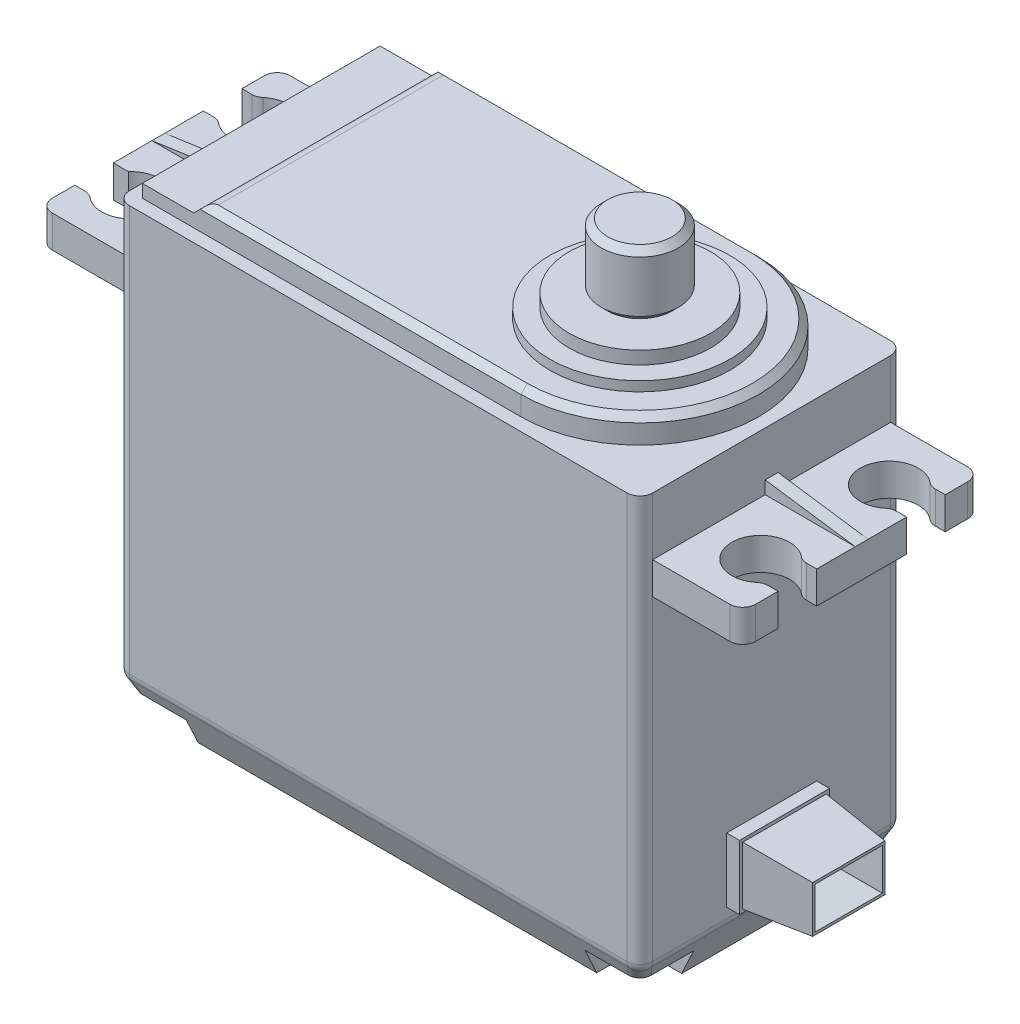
SolidWorks part; units mm, degrees
ref_plane "Alzado" through (0, 0, 0) normal (0, 0, 1) x (1, 0, 0)
ref_plane "Planta" through (0, 0, 0) normal (0, 1, 0) x (1, 0, 0)
ref_plane "Vista lateral" through (0, 0, 0) normal (1, 0, 0) x (0, 0, -1)
sketch "Croquis1" plane through (0, 0, 0) normal (0, 0, 1) x (1, 0, 0)
  line L1 (-20.35, -17.5) -> (20.35, -17.5)
  line L2 (-20.35, -17.5) -> (-20.35, 17.5)
  line L3 (-20.35, 17.5) -> (20.35, 17.5)
  line L4 (20.35, -17.5) -> (20.35, 17.5)
  line L5 (-20.35, -17.5) -> (20.35, 17.5) construction
  line L6 (-20.35, 17.5) -> (20.35, -17.5) construction
  point P0 (0, 0)
  dimension "D1" = 40.7
  dimension "D2" = 35
extrude "Saliente-Extruir1" add sketch "Croquis1" along normal mid plane 20.5
ref_plane "Plano1" through (0, 0, 9.25) normal (0, 0, 1) x (1, 0, 0)
sketch "Croquis2" plane through (0, 0, 9.25) normal (0, 0, 1) x (1, 0, 0)
  line L1 (-20.35, 13) -> (-27.35, 13)
  line L2 (-20.35, 13) -> (-20.35, 10.5)
  line L3 (-20.35, 10.5) -> (-27.35, 10.5)
  line L4 (-27.35, 13) -> (-27.35, 10.5)
  line L5 (-20.35, -17.5) -> (20.35, -17.5) construction
  line L6 (0, 17.5) -> (0, -17.5) construction
  line L7 (20.35, 17.5) -> (-20.35, 17.5) construction
  line L8 (20.35, 13) -> (20.35, 10.5)
  line L9 (20.35, 10.5) -> (27.35, 10.5)
  line L10 (27.35, 13) -> (27.35, 10.5)
  line L11 (20.35, 13) -> (27.35, 13)
  line L12 (-20.35, 17.5) -> (-20.35, -17.5) construction
  dimension "D1" = 2.5
  dimension "D2" = 7
  dimension "D3" = 28
extrude "Saliente-Extruir2" add sketch "Croquis2" against normal blind 18.5
sketch "Croquis3" plane through (0, 0, 0) normal (0, 0, 1) x (1, 0, 0)
  line L0 (-20.35, 14) -> (-20.35, 13)
  line L2 (-20.35, 13) -> (-27.35, 13)
  line L3 (-27.35, 13) -> (-20.35, 14)
  line L4 (20.35, 14) -> (27.35, 13)
  line L6 (27.35, 13) -> (20.35, 13)
  line L7 (20.35, 13) -> (20.35, 14)
  line L8 (-20.35, 17.5) -> (-20.35, -17.5) construction
  line L9 (20.35, -17.5) -> (20.35, 17.5) construction
  dimension "D1" = 1
extrude "Saliente-Extruir3" add sketch "Croquis3" along normal mid plane 1
sketch "Croquis4" plane through (0, 13, 0) normal (0, 1, 0) x (1, 0, 0)
  line L0 (-27.35, 6.5) -> (-26.1771, 6.5)
  line L1 (-24.5, -5) -> (24.5, -5) construction
  line L2 (-24.5, -5) -> (-24.5, 5) construction
  line L3 (-24.5, 5) -> (24.5, 5) construction
  line L4 (24.5, -5) -> (24.5, 5) construction
  line L5 (-24.5, -5) -> (24.5, 5) construction
  line L6 (-24.5, 5) -> (24.5, -5) construction
  line L7 (-27.35, 9.25) -> (-27.35, 0.5) construction
  line L8 (-27.35, 3.5) -> (-26.1771, 3.5)
  line L9 (-27.35, -3.5) -> (-26.1771, -3.5)
  line L10 (-27.35, -0.5) -> (-27.35, -9.25) construction
  line L11 (-27.35, -6.5) -> (-26.1771, -6.5)
  line L12 (26.1771, -6.5) -> (27.35, -6.5)
  line L13 (27.35, -0.5) -> (27.35, -9.25) construction
  line L14 (27.35, -3.5) -> (26.1771, -3.5)
  line L15 (27.35, 3.5) -> (26.1771, 3.5)
  line L16 (27.35, 9.25) -> (27.35, 0.5) construction
  line L17 (27.35, 6.5) -> (26.1771, 6.5)
  line L18 (27.35, 6.5) -> (27.35, 3.5)
  line L19 (27.35, -3.5) -> (27.35, -6.5)
  line L20 (-27.35, -3.5) -> (-27.35, -6.5)
  line L21 (-27.35, 3.5) -> (-27.35, 6.5)
  line L22 (-27.35, 5) -> (-24.5, 5) construction
  line L23 (-24.5, -5) -> (-27.35, -5) construction
  line L24 (24.5, -5) -> (27.35, -5) construction
  line L25 (24.5, 5) -> (27.35, 5) construction
  arc A0 (26.1771, 6.5) -> (26.1771, 3.5) centre (24.5, 5) ccw
  arc A1 (26.1771, -3.5) -> (26.1771, -6.5) centre (24.5, -5) ccw
  arc A2 (-26.1771, -6.5) -> (-26.1771, -3.5) centre (-24.5, -5) ccw
  arc A3 (-26.1771, 3.5) -> (-26.1771, 6.5) centre (-24.5, 5) ccw
  point P0 (0, 0)
  dimension "D3" = 4.5
  dimension "D1" = 49
  dimension "D2" = 10
  dimension "D4" = 3
extrude "Cortar-Extruir1" cut sketch "Croquis4" against normal up to vertex
chamfer "Chaflán1" distance 1.5 angle 65 4 edges at (0, -17.5, -10.25) (-20.35, -17.5, 0) (0, -17.5, 10.25) (20.35, -17.5, 0)
sketch "Croquis5" plane through (0, -17.5, 0) normal (0, -1, 0) x (1, 0, 0)
  line L0 (-17.5, 0) -> (17.5, 0) construction
  line L1 (-17.5, -7.5) -> (17.5, -7.5) construction
  line L2 (-17.5, -7.5) -> (-17.5, 7.5) construction
  line L3 (-17.5, 7.5) -> (17.5, 7.5) construction
  line L4 (17.5, -7.5) -> (17.5, 7.5) construction
  line L5 (-17.5, -7.5) -> (17.5, 7.5) construction
  line L6 (-17.5, 7.5) -> (17.5, -7.5) construction
  line L7 (0, 7.5) -> (0, -7.5) construction
  line L8 (-20.35, 5.5) -> (-17.5, 5.5)
  line L10 (-15.5, 7.5) -> (-15.5, 10.25)
  line L12 (-20.35, 10.25) -> (20.35, 10.25) construction
  line L13 (-20.35, -9.25) -> (-20.35, 9.25) construction
  line L14 (-15.5, 10.25) -> (-20.35, 10.25)
  line L15 (-20.35, 10.25) -> (-20.35, 5.5)
  line L16 (-20.35, -10.25) -> (-20.35, -5.5)
  line L17 (-15.5, -10.25) -> (-20.35, -10.25)
  line L18 (-15.5, -7.5) -> (-15.5, -10.25)
  line L19 (-20.35, -5.5) -> (-17.5, -5.5)
  line L20 (20.35, -5.5) -> (17.5, -5.5)
  line L21 (15.5, -7.5) -> (15.5, -10.25)
  line L22 (15.5, -10.25) -> (20.35, -10.25)
  line L23 (20.35, -10.25) -> (20.35, -5.5)
  line L24 (20.35, 10.25) -> (20.35, 5.5)
  line L25 (15.5, 10.25) -> (20.35, 10.25)
  line L26 (15.5, 7.5) -> (15.5, 10.25)
  line L27 (20.35, 5.5) -> (17.5, 5.5)
  arc A0 (-17.5, 5.5) -> (-15.5, 7.5) centre (-17.5, 7.5) ccw
  arc A1 (-17.5, -5.5) -> (-15.5, -7.5) centre (-17.5, -7.5) cw
  arc A2 (17.5, -5.5) -> (15.5, -7.5) centre (17.5, -7.5) ccw
  arc A3 (17.5, 5.5) -> (15.5, 7.5) centre (17.5, 7.5) cw
  point P0 (0, 0)
  dimension "D3" = 2
  dimension "D1" = 35
  dimension "D2" = 15
extrude "Cortar-Extruir2" cut sketch "Croquis5" against normal blind 2
sketch "Croquis6" plane through (0, 17.5, 0) normal (0, 1, 0) x (1, 0, 0)
  line L1 (20.35, 10.25) -> (-20.35, 10.25) construction
  line L2 (-20.35, -10.25) -> (-20.35, 10.25) construction
  line L3 (20.35, -10.25) -> (-20.35, -10.25) construction
  line L4 (20.35, -10.25) -> (20.35, 10.25) construction
  line L5 (20.35, 10.25) -> (-20.35, 10.25) construction
  line L6 (-20.35, -10.25) -> (-20.35, 10.25) construction
  line L7 (20.35, -10.25) -> (-20.35, -10.25) construction
  line L8 (20.35, -10.25) -> (20.35, 10.25) construction
  line L9 (10.1, 9.25) -> (-19.35, 9.25)
  line L10 (-19.35, -9.25) -> (-19.35, 9.25)
  line L11 (10.1, -9.25) -> (-19.35, -9.25)
  line L12 (19.35, -9.25) -> (19.35, 9.25) construction
  line L13 (19.35, 9.25) -> (-19.35, 9.25) construction
  line L14 (19.35, -9.25) -> (-19.35, -9.25) construction
  arc A0 (10.1, -9.25) -> (10.1, 9.25) centre (10.1, 0) ccw
  dimension "D1" = 1
extrude "Saliente-Extruir4" add sketch "Croquis6" along normal blind 2
sketch "Croquis9" plane through (0, 0, 9.25) normal (0, 0, 1) x (1, 0, 0)
  line L0 (-19.35, 19.5) -> (-19.35, 18.5)
  line L2 (-19.35, 18.5) -> (-15.35, 18.5)
  line L3 (-15.35, 18.5) -> (-14.35, 19.5)
  line L5 (-14.35, 19.5) -> (-19.35, 19.5)
  line L7 (-19.35, 19.5) -> (-19.35, 17.5) construction
  line L8 (-19.35, 19.5) -> (10.1, 19.5) construction
  dimension "D1" = 5
  dimension "D2" = 45
extrude "Cortar-Extruir3" cut sketch "Croquis9" against normal up to vertex
sketch "Croquis10" plane through (0, 19.5, 0) normal (0, 1, 0) x (1, 0, 0)
  circle A1 centre (10.1, 0) radius 7
  arc A2 (10.1, -9.25) -> (10.1, 9.25) centre (10.1, 0) ccw construction
  dimension "D1" = 14
extrude "Saliente-Extruir5" add sketch "Croquis10" along normal blind 0.75
sketch "Croquis11" plane through (0, 20.25, 0) normal (0, 1, 0) x (1, 0, 0)
  circle A0 centre (10.1, 0) radius 5.5
  circle A1 centre (10.1, 0) radius 7
  circle A2 centre (10.1, 0) radius 7 construction
  dimension "D1" = 0
  dimension "D2" = 1.5
extrude "Saliente-Extruir6" add sketch "Croquis11" along normal blind 1
sketch "Croquis12" plane through (0, 21.25, 0) normal (0, 1, 0) x (1, 0, 0)
  circle A0 centre (10.1, 0) radius 3
  circle A1 centre (10.1, 0) radius 5.5 construction
  dimension "D1" = 6
extrude "Saliente-Extruir7" add sketch "Croquis12" along normal blind 5
sketch "Croquis14" plane through (20.35, 0, 0) normal (1, 0, 0) x (0, 0, -1)
  line L0 (0, 0) -> (0, -10.7832) construction
  line L1 (-3.5, -13.2832) -> (3.5, -13.2832)
  line L2 (-3.5, -13.2832) -> (-3.5, -8.2832)
  line L3 (-3.5, -8.2832) -> (3.5, -8.2832)
  line L4 (3.5, -13.2832) -> (3.5, -8.2832)
  line L5 (-3.5, -13.2832) -> (3.5, -8.2832) construction
  line L6 (-3.5, -8.2832) -> (3.5, -13.2832) construction
  line L7 (-10.25, -14.2832) -> (10.25, -14.2832) construction
  point P0 (0, -10.7832)
  dimension "D1" = 7
  dimension "D2" = 5
  dimension "D3" = 3.5
extrude "Saliente-Extruir8" add sketch "Croquis14" along normal blind 1
sketch "Croquis15" plane through (21.35, 0, 0) normal (1, 0, 0) x (0, 0, -1)
  line L0 (3.25, -8.5332) -> (-3.25, -8.5332)
  line L1 (-3.25, -8.5332) -> (-3.25, -13.0332)
  line L2 (-3.25, -13.0332) -> (3.25, -13.0332)
  line L3 (3.25, -13.0332) -> (3.25, -8.5332)
  line L4 (3.5, -13.2832) -> (3.5, -8.2832)
  line L5 (3.5, -8.2832) -> (-3.5, -8.2832)
  line L6 (-3.5, -8.2832) -> (-3.5, -13.2832)
  line L7 (-3.5, -13.2832) -> (3.5, -13.2832)
  line L8 (3.5, -13.2832) -> (3.5, -8.2832) construction
  line L9 (3.5, -8.2832) -> (-3.5, -8.2832) construction
  line L10 (-3.5, -8.2832) -> (-3.5, -13.2832) construction
  line L11 (-3.5, -13.2832) -> (3.5, -13.2832) construction
  dimension "D1" = 0
  dimension "D2" = 0.25
extrude "Saliente-Extruir9" add sketch "Croquis15" along normal blind 5 draft 5 separate body
shell "Vaciado2" thickness 0.2
chamfer "Chaflán2" distance 0.5 angle 45 1 edges at (10.1, 26.25, 3)
sketch "Croquis13" plane through (0, 0, 0) normal (0, 0, 1) x (1, 0, 0)
  line L0 (7.1, 21.75) -> (7.1, 21.25)
  line L1 (7.1, 25.75) -> (7.1, 21.25) construction
  line L2 (7.1, 21.25) -> (7.6, 21.25)
  line L3 (15.6, 21.25) -> (4.6, 21.25) construction
  line L4 (7.6, 21.25) -> (7.1, 21.75)
  line L5 (7.6, 26.25) -> (7.1, 25.75) construction
  line L6 (10.1, 26.25) -> (10.1, 21.25) construction
  line L7 (12.6, 26.25) -> (7.6, 26.25) construction
revolve "Cortar-Revolución1" cut sketch "Croquis13" angle 360 about L6
fillet "Redondeo2" radius 1 24 edges at (20.0663, -14.8916, 9.9663) (20.35, 1.6084, 10.25) (-20.0663, -14.8916, 9.9663) (-20.35, 1.6084, 10.25) (-20.0663, -14.8916, -9.9663) (-20.35, 1.6084, -10.25) (20.0663, -14.8916, -9.9663) (20.35, 1.6084, -10.25) (-14.35, 19.5, 0) (-26.1771, 11.75, 6.5) (-26.1771, 11.75, -3.5) (-26.1771, 11.75, -6.5) (26.1771, 11.75, -6.5) (26.1771, 11.75, 3.5) (26.1771, 11.75, -3.5) (26.1771, 11.75, 6.5) (27.35, 11.75, 9.25) (27.35, 11.75, -9.25) (-27.35, 11.75, 9.25) (-27.35, 11.75, -9.25) (-20.35, -14.2832, 0) (0, -14.2832, 10.25) (20.35, -14.2832, 0) (0, -14.2832, -10.25)
sketch "Croquis16" plane through (0, 13, 0) normal (0, 1, 0) x (1, 0, 0)
  line L0 (-20.35, 9.25) -> (-26.35, 9.25) construction
  line L1 (-27.35, 8.25) -> (-27.35, 6.5) construction
  line L2 (-26.5767, 6.5) -> (-27.35, 6.5) construction
  line L3 (-27.35, 3.5) -> (-26.5767, 3.5) construction
  line L4 (-27.35, 3.5) -> (-27.35, 0.5) construction
  line L5 (-27.35, -0.5) -> (-27.35, -3.5) construction
  line L6 (-27.35, -0.5) -> (-27.35, 0.5) construction
  line L7 (-26.1771, -3.5) -> (-27.35, -3.5) construction
  line L8 (-27.35, -6.5) -> (-26.5767, -6.5) construction
  line L9 (-27.35, -6.5) -> (-27.35, -8.25) construction
  line L10 (-20.35, -9.25) -> (-26.35, -9.25) construction
  line L11 (19.35, -10.25) -> (-19.35, -10.25) construction
  line L12 (26.35, -9.25) -> (20.35, -9.25) construction
  line L13 (27.35, -6.5) -> (27.35, -8.25) construction
  line L14 (26.5767, -6.5) -> (27.35, -6.5) construction
  line L15 (27.35, -3.5) -> (26.5767, -3.5) construction
  line L16 (27.35, -0.5) -> (27.35, -3.5) construction
  line L17 (27.35, -0.5) -> (27.35, 0.5) construction
  line L18 (27.35, 3.5) -> (27.35, 0.5) construction
  line L19 (26.5767, 3.5) -> (27.35, 3.5) construction
  line L20 (27.35, 6.5) -> (26.5767, 6.5) construction
  line L21 (27.35, 8.25) -> (27.35, 6.5) construction
  line L22 (26.35, 9.25) -> (20.35, 9.25) construction
  line L23 (19.35, 10.25) -> (-19.35, 10.25) construction
  line L24 (-20.35, 9.25) -> (-26.35, 9.25)
  line L25 (-27.35, 8.25) -> (-27.35, 6.5)
  line L26 (-26.5767, 6.5) -> (-27.35, 6.5)
  line L27 (-27.35, 3.5) -> (-26.5767, 3.5)
  line L28 (-27.35, 3.5) -> (-27.35, 0.5)
  line L29 (-27.35, -0.5) -> (-27.35, -3.5)
  line L30 (-27.35, -0.5) -> (-27.35, 0.5)
  line L31 (-26.1771, -3.5) -> (-27.35, -3.5)
  line L32 (-27.35, -6.5) -> (-26.5767, -6.5)
  line L33 (-27.35, -6.5) -> (-27.35, -8.25)
  line L34 (-20.35, -9.25) -> (-26.35, -9.25)
  line L35 (19.35, -10.25) -> (-19.35, -10.25)
  line L36 (26.35, -9.25) -> (20.35, -9.25)
  line L37 (27.35, -6.5) -> (27.35, -8.25)
  line L38 (26.5767, -6.5) -> (27.35, -6.5)
  line L39 (27.35, -3.5) -> (26.5767, -3.5)
  line L40 (27.35, -0.5) -> (27.35, -3.5)
  line L41 (27.35, -0.5) -> (27.35, 0.5)
  line L42 (27.35, 3.5) -> (27.35, 0.5)
  line L43 (26.5767, 3.5) -> (27.35, 3.5)
  line L44 (27.35, 6.5) -> (26.5767, 6.5)
  line L45 (27.35, 8.25) -> (27.35, 6.5)
  line L46 (26.35, 9.25) -> (20.35, 9.25)
  line L47 (19.35, 10.25) -> (-19.35, 10.25)
  arc A0 (-26.35, 9.25) -> (-27.35, 8.25) centre (-26.35, 8.25) ccw construction
  arc A1 (-26.5767, 6.5) -> (-25.9377, 6.7308) centre (-26.5767, 7.5) ccw construction
  arc A2 (-25.9377, 3.2692) -> (-25.9377, 6.7308) centre (-24.5, 5) ccw construction
  arc A3 (-25.9377, 3.2692) -> (-26.5767, 3.5) centre (-26.5767, 2.5) ccw construction
  arc A4 (-25.9377, -6.7308) -> (-26.1771, -3.5) centre (-24.5, -5) ccw construction
  arc A5 (-25.9377, -6.7308) -> (-26.5767, -6.5) centre (-26.5767, -7.5) ccw construction
  arc A6 (-27.35, -8.25) -> (-26.35, -9.25) centre (-26.35, -8.25) ccw construction
  arc A7 (-20.35, -9.25) -> (-19.35, -10.25) centre (-19.35, -9.25) ccw construction
  arc A8 (19.35, -10.25) -> (20.35, -9.25) centre (19.35, -9.25) ccw construction
  arc A9 (26.35, -9.25) -> (27.35, -8.25) centre (26.35, -8.25) ccw construction
  arc A10 (26.5767, -6.5) -> (25.9377, -6.7308) centre (26.5767, -7.5) ccw construction
  arc A11 (25.9377, -3.2692) -> (25.9377, -6.7308) centre (24.5, -5) ccw construction
  arc A12 (25.9377, -3.2692) -> (26.5767, -3.5) centre (26.5767, -2.5) ccw construction
  arc A13 (26.5767, 3.5) -> (25.9377, 3.2692) centre (26.5767, 2.5) ccw construction
  arc A14 (25.9377, 6.7308) -> (25.9377, 3.2692) centre (24.5, 5) ccw construction
  arc A15 (25.9377, 6.7308) -> (26.5767, 6.5) centre (26.5767, 7.5) ccw construction
  arc A16 (27.35, 8.25) -> (26.35, 9.25) centre (26.35, 8.25) ccw construction
  arc A17 (20.35, 9.25) -> (19.35, 10.25) centre (19.35, 9.25) ccw construction
  arc A18 (-19.35, 10.25) -> (-20.35, 9.25) centre (-19.35, 9.25) ccw construction
  circle A19 centre (10.1, 0) radius 2.5 construction
  arc A20 (-26.35, 9.25) -> (-27.35, 8.25) centre (-26.35, 8.25) ccw
  arc A21 (-26.5767, 6.5) -> (-25.9377, 6.7308) centre (-26.5767, 7.5) ccw
  arc A22 (-25.9377, 3.2692) -> (-25.9377, 6.7308) centre (-24.5, 5) ccw
  arc A23 (-25.9377, 3.2692) -> (-26.5767, 3.5) centre (-26.5767, 2.5) ccw
  arc A24 (-25.9377, -6.7308) -> (-26.1771, -3.5) centre (-24.5, -5) ccw
  arc A25 (-25.9377, -6.7308) -> (-26.5767, -6.5) centre (-26.5767, -7.5) ccw
  arc A26 (-27.35, -8.25) -> (-26.35, -9.25) centre (-26.35, -8.25) ccw
  arc A27 (-20.35, -9.25) -> (-19.35, -10.25) centre (-19.35, -9.25) ccw
  arc A28 (19.35, -10.25) -> (20.35, -9.25) centre (19.35, -9.25) ccw
  arc A29 (26.35, -9.25) -> (27.35, -8.25) centre (26.35, -8.25) ccw
  arc A30 (26.5767, -6.5) -> (25.9377, -6.7308) centre (26.5767, -7.5) ccw
  arc A31 (25.9377, -3.2692) -> (25.9377, -6.7308) centre (24.5, -5) ccw
  arc A32 (25.9377, -3.2692) -> (26.5767, -3.5) centre (26.5767, -2.5) ccw
  arc A33 (26.5767, 3.5) -> (25.9377, 3.2692) centre (26.5767, 2.5) ccw
  arc A34 (25.9377, 6.7308) -> (25.9377, 3.2692) centre (24.5, 5) ccw
  arc A35 (25.9377, 6.7308) -> (26.5767, 6.5) centre (26.5767, 7.5) ccw
  arc A36 (27.35, 8.25) -> (26.35, 9.25) centre (26.35, 8.25) ccw
  arc A37 (20.35, 9.25) -> (19.35, 10.25) centre (19.35, 9.25) ccw
  arc A38 (-19.35, 10.25) -> (-20.35, 9.25) centre (-19.35, 9.25) ccw
  circle A39 centre (10.1, 0) radius 2.5
sketch "Croquis17" plane through (-20.35, 0, 0) normal (-1, 0, 0) x (0, 0, 1)
  line L0 (-9.0429, 19.2071) -> (-9.25, 19) construction
  line L1 (-8.75, 19.5) -> (-9.0429, 19.2071) construction
  line L2 (-8.75, 19.5) -> (8.75, 19.5) construction
  line L3 (-9.25, 18.5) -> (-9.25, 19) construction
  line L4 (-9.25, 18.5) -> (-9.25, 17.5) construction
  line L5 (-9.25, 17.5) -> (-10.25, 17.5) construction
  line L6 (-10.25, -14.0615) -> (-10.25, 17.5) construction
  line L7 (-9.6826, -15.5) -> (-10.1563, -14.4842) construction
  line L8 (-9.6826, -15.5) -> (-8.75, -17.5) construction
  line L9 (-8.75, -17.5) -> (-7.5, -17.5) construction
  line L10 (-7.5, -17.5) -> (-5.5, -17.5) construction
  line L11 (5.5, -17.5) -> (-5.5, -17.5) construction
  line L12 (5.5, -17.5) -> (7.5, -17.5) construction
  line L13 (7.5, -17.5) -> (8.75, -17.5) construction
  line L14 (8.75, -17.5) -> (9.6826, -15.5) construction
  line L15 (10.1563, -14.4842) -> (9.6826, -15.5) construction
  line L16 (10.25, 17.5) -> (10.25, -14.0615) construction
  line L17 (10.25, 17.5) -> (9.25, 17.5) construction
  line L18 (9.25, 18.5) -> (9.25, 17.5) construction
  line L19 (9.25, 18.5) -> (9.25, 19) construction
  line L20 (9.25, 19) -> (9.0429, 19.2071) construction
  line L21 (9.0429, 19.2071) -> (8.75, 19.5) construction
  line L22 (-9.0429, 19.2071) -> (-9.25, 19)
  line L23 (-8.75, 19.5) -> (-9.0429, 19.2071)
  line L24 (-8.75, 19.5) -> (8.75, 19.5)
  line L25 (-9.25, 18.5) -> (-9.25, 19)
  line L26 (-9.25, 18.5) -> (-9.25, 17.5)
  line L27 (-9.25, 17.5) -> (-10.25, 17.5)
  line L28 (-10.25, -14.0615) -> (-10.25, 17.5)
  line L29 (-9.6826, -15.5) -> (-10.1563, -14.4842)
  line L30 (-9.6826, -15.5) -> (-8.75, -17.5)
  line L31 (-8.75, -17.5) -> (-7.5, -17.5)
  line L32 (-7.5, -17.5) -> (-5.5, -17.5)
  line L33 (5.5, -17.5) -> (-5.5, -17.5)
  line L34 (5.5, -17.5) -> (7.5, -17.5)
  line L35 (7.5, -17.5) -> (8.75, -17.5)
  line L36 (8.75, -17.5) -> (9.6826, -15.5)
  line L37 (10.1563, -14.4842) -> (9.6826, -15.5)
  line L38 (10.25, 17.5) -> (10.25, -14.0615)
  line L39 (10.25, 17.5) -> (9.25, 17.5)
  line L40 (9.25, 18.5) -> (9.25, 17.5)
  line L41 (9.25, 18.5) -> (9.25, 19)
  line L42 (9.25, 19) -> (9.0429, 19.2071)
  line L43 (9.0429, 19.2071) -> (8.75, 19.5)
  arc A0 (-10.25, -14.0615) -> (-10.1563, -14.4842) centre (-9.25, -14.0615) ccw construction
  arc A1 (10.1563, -14.4842) -> (10.25, -14.0615) centre (9.25, -14.0615) ccw construction
  arc A2 (-10.25, -14.0615) -> (-10.1563, -14.4842) centre (-9.25, -14.0615) ccw
  arc A3 (10.1563, -14.4842) -> (10.25, -14.0615) centre (9.25, -14.0615) ccw
sketch "Croquis18" plane through (0, 10.5, 0) normal (0, -1, 0) x (1, 0, 0)
  line L0 (-24.5, 5) -> (24.5, 5) construction
  line L1 (24.5, 5) -> (24.5, -5) construction
  line L2 (10.1, 0) -> (24.5, 0) construction
sketch "Croquis19" plane through (0, -17.5, 0) normal (0, -1, 0) x (1, 0, 0)
  line L0 (-20.35, 0) -> (20.35, 0) construction
  line L3 (-20.35, -9.25) -> (-20.35, 9.25) construction
  line L4 (20.35, 9.25) -> (20.35, -9.25) construction
sketch "Croquis21" plane through (0, -17.5, 0) normal (0, -1, 0) x (1, 0, 0)
  line L0 (10.1, 0) -> (10.1, -10.25) construction
  line L1 (19.35, -10.25) -> (-19.35, -10.25) construction
  line L2 (10.1, 0) -> (24.5, 0) construction
  line L3 (24.5, 0) -> (24.5, 5) construction
  line L4 (24.5, 0) -> (24.5, -5) construction
